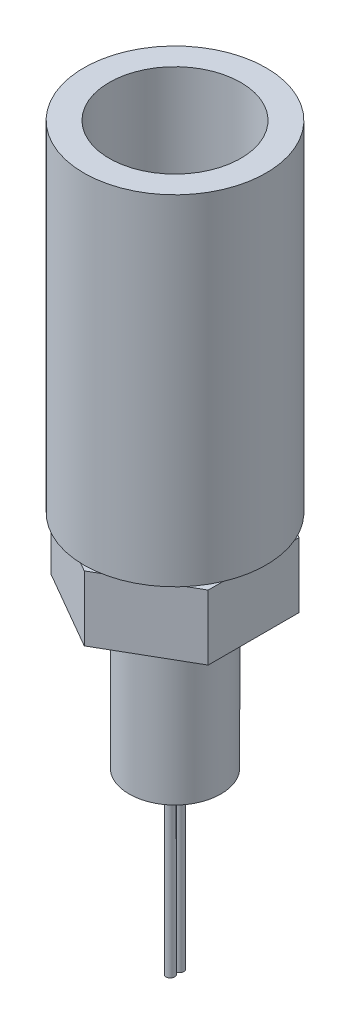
SolidWorks part; units mm, degrees
ref_plane "Front" through (0, 0, 0) normal (0, 0, 1) x (1, 0, 0)
ref_plane "Top" through (0, 0, 0) normal (0, 1, 0) x (1, 0, 0)
ref_plane "Right" through (0, 0, 0) normal (1, 0, 0) x (0, 0, -1)
sketch "Sketch1" plane through (0, 0, 0) normal (0, 1, 0) x (1, 0, 0)
  line L1 (0, 10.9985) -> (-9.525, 5.4993)
  line L2 (-9.525, 5.4993) -> (-9.525, -5.4993)
  line L3 (-9.525, -5.4993) -> (0, -10.9985)
  line L4 (0, -10.9985) -> (9.525, -5.4993)
  line L5 (9.525, -5.4993) -> (9.525, 5.4993)
  line L6 (9.525, 5.4993) -> (0, 10.9985)
  circle A0 centre (0, 0) radius 9.525 construction
  dimension "D1" = 19.05
extrude "Extrude1" add sketch "Sketch1" along normal blind 7.874
sketch "Sketch2" plane through (0, 0, 0) normal (0, 0, 1) x (1, 0, 0)
  line L0 (0, 0) -> (0, -1.8388) construction
  line L1 (8.8011, 7.874) -> (8.8011, 11.6586)
  line L2 (0, 7.874) -> (9.525, 7.874) construction
  line L3 (8.8011, 11.6586) -> (9.398, 11.6586)
  line L4 (9.398, 11.6586) -> (9.398, 13.2334)
  line L5 (9.398, 13.2334) -> (8.8011, 13.2334)
  line L6 (8.8011, 13.2334) -> (8.8011, 14.8844)
  line L7 (8.8011, 14.8844) -> (9.398, 14.8844)
  line L8 (9.398, 14.8844) -> (9.398, 16.4592)
  line L9 (9.398, 16.4592) -> (8.8011, 16.4592)
  line L10 (8.8011, 16.4592) -> (8.8011, 17.272)
  line L11 (8.8011, 17.272) -> (0, 17.272)
  line L12 (0, 17.272) -> (0, 7.874)
  line L13 (-9.398, 11.6586) -> (-9.398, 13.2334) construction
  line L14 (-8.8011, 7.874) -> (-8.8011, 11.6586) construction
  line L15 (8.8011, 7.874) -> (0, 7.874)
  dimension "D1" = 17.6022
  dimension "D2" = 18.796
  dimension "D3" = 1.5748
  dimension "D4" = 1.651
  dimension "D5" = 0.8128
  dimension "D6" = 9.398
revolve "Revolve1" add sketch "Sketch2" angle 360 about L0
sketch "Sketch3" plane through (0, 17.272, 0) normal (0, 1, 0) x (-1, 0, 0)
  circle A0 centre (0, 0) radius 7.875
  dimension "D1" = 15.75
extrude "Extrude2" add sketch "Sketch3" along normal blind 10.41
sketch "Sketch4" plane through (0, 27.682, 0) normal (0, 1, 0) x (-1, 0, 0)
  line L1 (0, 0) -> (0, 11.7626) construction
  circle A1 centre (0, 0) radius 4.318 construction
  circle A2 centre (-4.318, 0) radius 0.955
  circle A3 centre (4.318, 0) radius 0.955
  dimension "D1" = 1.91
  dimension "D2" = 8.636
extrude "Extrude8" cut sketch "Sketch4" against normal up to surface (10.41 mm away)
sketch "1" plane through (0.0995, 27.682, 4.4802) normal (0, 1, 0) x (-1, 0, 0)
  circle A0 centre (0.0995, -9.611) radius 0.762
  dimension "D1" = 1.524
  dimension "D2" = 5.1308
  dimension "D3" = 6.706
extrude "Extrude9" cut sketch "1" against normal up to surface (10.41 mm away)
sketch "Sketch8" plane through (0, 0, 0) normal (0, -1, 0) x (1, 0, 0)
  circle A0 centre (0, 0) radius 5.5562
  dimension "D1" = 11.1125
extrude "Extrude7" add sketch "Sketch8" along normal blind 18.2803
sketch "Sketch9" plane through (0, 0, 0) normal (0, 0, 1) x (1, 0, 0)
  line L0 (0, 0) -> (0, -1.4263) construction
  circle A0 centre (7.1, 0.2843) radius 0.89
  circle A1 centre (-7.1, 0.2843) radius 0.89 construction
  dimension "D1" = 1.78
  dimension "D2" = 12.42
revolve "o-ring 12.42x1.78" add sketch "Sketch9" angle 360 about L0
sketch "Sketch10" plane through (0, 0, 0) normal (0, 0, 1) x (1, 0, 0)
  line L0 (9.0805, 8.5119) -> (9.0805, 11.5824)
  line L1 (9.0805, 11.5824) -> (9.9445, 11.5824)
  line L2 (9.9445, 11.5824) -> (9.9445, 13.2334)
  line L3 (9.9445, 13.2334) -> (9.0805, 13.2334)
  line L4 (9.398, 13.2334) -> (-9.398, 13.2334) construction
  line L5 (9.0805, 13.2334) -> (9.0805, 14.7574)
  line L6 (9.0805, 14.7574) -> (9.9445, 14.7574)
  line L7 (9.9445, 14.7574) -> (9.9445, 19.0036)
  line L8 (9.9445, 19.0036) -> (7.9756, 19.0036)
  line L9 (7.9756, 19.0036) -> (7.9756, 49.6599)
  line L10 (9.0805, 8.5119) -> (11.049, 8.5119)
  line L11 (11.049, 8.5119) -> (11.049, 49.6599)
  line L12 (11.049, 49.6599) -> (7.9756, 49.6599)
  line L13 (0, 0) -> (0, 44.7429) construction
  line L14 (-11.049, 8.5119) -> (-11.049, 49.6599) construction
  line L15 (-9.9445, 11.5824) -> (-9.9445, 13.2334) construction
  line L16 (-9.0805, 8.5119) -> (-9.0805, 11.5824) construction
  line L17 (-7.9756, 19.0036) -> (-7.9756, 49.6599) construction
  dimension "D1" = 41.148
  dimension "D2" = 18.161
  dimension "D3" = 15.9512
  dimension "D4" = 1.651
  dimension "D5" = 1.524
  dimension "D6" = 22.098
  dimension "D7" = 3.0705
revolve "Locking Sleeve" add sketch "Sketch10" angle 360 about L13
sketch "Sketch11" plane through (0, -18.2803, 0) normal (0, -1, 0) x (1, 0, 0)
  circle A0 centre (0, 0.5588) radius 0.5207
  circle A1 centre (0, -0.5588) radius 0.5207
  dimension "D1" = 0.5588
  dimension "D3" = 1.0414
  dimension "D2" = 0.5588
extrude "Extrude10" add sketch "Sketch11" along normal blind 21.4312
